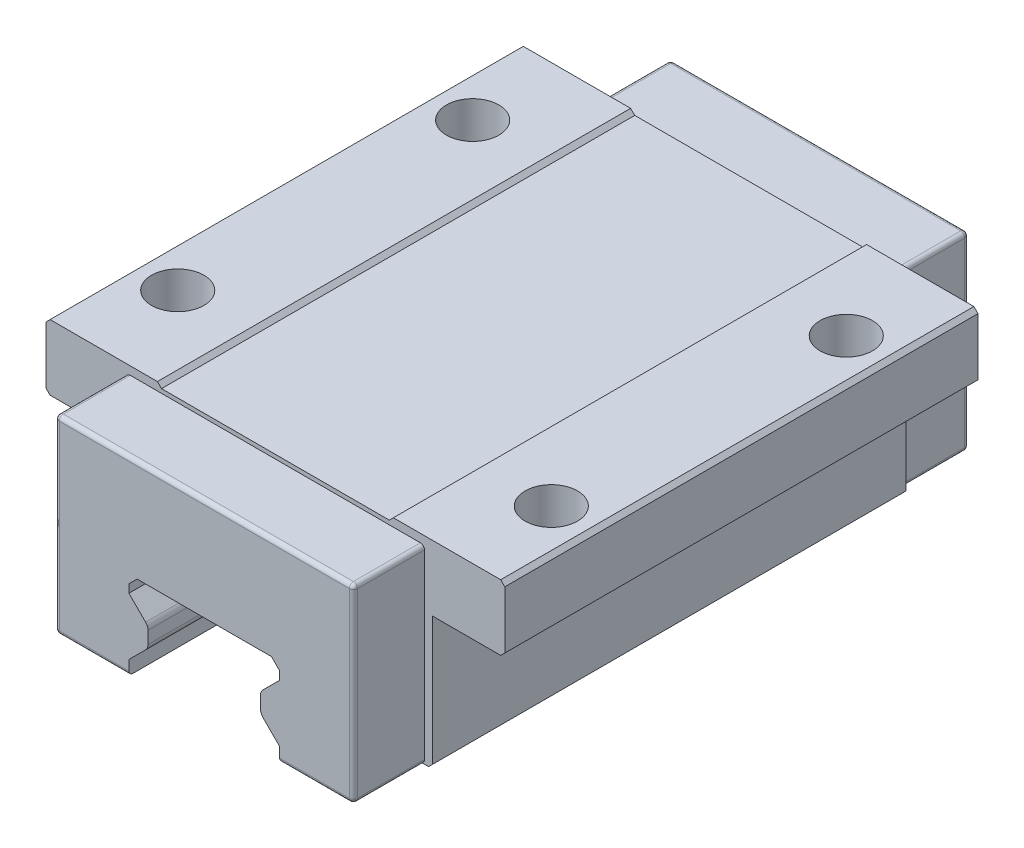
SolidWorks part; units mm, degrees
ref_plane "Front Plane" through (0, 0, 0) normal (0, 0, 1) x (1, 0, 0)
ref_plane "Top Plane" through (0, 0, 0) normal (0, 1, 0) x (1, 0, 0)
ref_plane "Right Plane" through (0, 0, 0) normal (1, 0, 0) x (0, 0, -1)
sketch "Sketch1" plane through (0, 0, 0) normal (0, 0, 1) x (1, 0, 0)
  line L1 (-24, 5.8) -> (24, 5.8)
  line L2 (-24, 5.8) -> (-24, 36)
  line L3 (-24, 36) -> (24, 36)
  line L4 (24, 5.8) -> (24, 36)
  line L5 (-24, 5.8) -> (24, 36) construction
  line L6 (-24, 36) -> (24, 5.8) construction
  point P0 (0, 20.9)
  dimension "D1" = 36
  dimension "D2" = 5.8
  dimension "D3" = 48
extrude "Boss-Extrude1" add sketch "Sketch1" along normal mid plane 72.2
sketch "Sketch2" plane through (0, 0, 0) normal (0, 0, 1) x (1, 0, 0)
  line L0 (-24, 5.8) -> (24, 5.8) construction
  line L1 (-22.75, 5.8) -> (22.75, 5.8)
  line L2 (-22.75, 5.8) -> (-22.75, 34.75)
  line L3 (-22.75, 34.75) -> (22.75, 34.75)
  line L4 (22.75, 5.8) -> (22.75, 34.75)
  line L5 (-22.75, 34.75) -> (-24, 34.75) construction
  line L6 (-24, 36) -> (-24, 5.8) construction
  line L7 (22.75, 34.75) -> (22.75, 36) construction
  line L8 (24, 36) -> (-24, 36) construction
  line L9 (22.75, 34.75) -> (24, 34.75) construction
  line L10 (24, 5.8) -> (24, 36) construction
  point P9 (0, 34.75)
  dimension "D1" = 1.25
extrude "Boss-Extrude2" add sketch "Sketch2" along normal mid plane 93.9
sketch "Sketch3" plane through (0, 0, 46.95) normal (0, 0, 1) x (1, 0, 0)
  line L1 (-11.5, 19.2) -> (11.5, 19.2)
  line L2 (-11.5, 19.2) -> (-11.5, 0)
  line L3 (-11.5, 0) -> (11.5, 0)
  line L4 (11.5, 19.2) -> (11.5, 0)
  line L5 (-11.5, 19.2) -> (11.5, 0) construction
  line L6 (-11.5, 0) -> (11.5, 19.2) construction
  point P0 (0, 9.6)
  dimension "D1" = 23
  dimension "D2" = 19.2
extrude "Cut-Extrude1" cut sketch "Sketch3" against normal through all
sketch "Sketch4" plane through (0, 0, 46.95) normal (0, 0, 1) x (1, 0, 0)
  line L0 (-11.5, 16.7) -> (-11.5, 7.95)
  line L1 (-11.5, 19.2) -> (-11.5, 5.8) construction
  line L2 (-11.5, 7.95) -> (-8.5833, 10.8667)
  line L3 (-8.5833, 10.8667) -> (-8.5833, 13.7833)
  line L4 (-8.5833, 13.7833) -> (-11.5, 16.7)
  line L5 (11.5, 19.2) -> (-11.5, 19.2) construction
  line L6 (-8.5833, 13.7833) -> (-11.5, 13.7833) construction
  line L7 (-8.5833, 10.8667) -> (-11.5, 10.8667) construction
  line L8 (-10.0417, 13.7833) -> (-10.0417, 10.8667) construction
  line L9 (0, 0) -> (0, 19.2) construction
  line L10 (10.0417, 13.7833) -> (10.0417, 10.8667) construction
  line L11 (8.5833, 10.8667) -> (11.5, 10.8667) construction
  line L12 (8.5833, 13.7833) -> (11.5, 13.7833) construction
  line L13 (8.5833, 13.7833) -> (11.5, 16.7)
  line L14 (8.5833, 10.8667) -> (8.5833, 13.7833)
  line L15 (11.5, 7.95) -> (8.5833, 10.8667)
  line L16 (11.5, 16.7) -> (11.5, 7.95)
extrude "Boss-Extrude3" add sketch "Sketch4" against normal up to surface (93.9 mm away)
chamfer "Chamfer1" distance 1.25 angle 45 2 edges at (11.5, 19.2, 0) (-11.5, 19.2, 0)
fillet "Fillet1" radius 1.25 4 edges at (8.5833, 10.8667, 0) (8.5833, 13.7833, 0) (-8.5833, 10.8667, 0) (-8.5833, 13.7833, 0)
sketch "Sketch5" plane through (0, 0, 36.1) normal (0, 0, 1) x (1, 0, 0)
  line L0 (24, 36) -> (-24, 36) construction
  line L1 (-18, 36) -> (18, 36)
  line L2 (-18, 36) -> (-18, 35.375)
  line L3 (-18, 35.375) -> (18, 35.375)
  line L4 (18, 36) -> (18, 35.375)
  point P6 (0, 35.375)
  dimension "D1" = 36
  dimension "D2" = 0.625
extrude "Cut-Extrude2" cut sketch "Sketch5" against normal through all
chamfer "Chamfer2" distance 0.625 angle 45 6 edges at (24, 36, 0) (24, 5.8, 0) (-24, 5.8, 0) (-24, 36, 0) (18, 35.375, 0) (-18, 35.375, 0)
fillet "Fillet2" radius 0.625 18 edges at (-22.75, 5.8, -41.525) (17.125, 5.8, 46.95) (17.125, 5.8, -46.95) (-22.75, 5.8, 41.525) (-17.125, 5.8, -46.95) (-17.125, 5.8, 46.95) (22.75, 5.8, 41.525) (-22.75, 20.275, 46.95) (-22.75, 20.275, -46.95) (-22.75, 34.75, 41.525) (22.75, 34.75, 41.525) (22.75, 20.275, 46.95) (22.75, 20.275, -46.95) (0, 34.75, 46.95) (0, 34.75, -46.95) (22.75, 5.8, -41.525) (22.75, 34.75, -41.525) (-22.75, 34.75, -41.525)
sketch "Sketch7" plane through (0, 0, 0) normal (0, 0, 1) x (1, 0, 0)
  line L0 (-23.375, 36) -> (-35, 36)
  line L1 (-35, 36) -> (-35, 26)
  line L2 (-23.375, 36) -> (-23.375, 15.625)
  line L3 (-24, 35.375) -> (-24, 6.425) construction
  line L4 (-24, 15.625) -> (-23.375, 15.625)
  line L5 (-35, 26) -> (-34.375, 26)
  line L6 (0, 0) -> (0, 35.375) construction
  line L7 (-17.375, 35.375) -> (17.375, 35.375) construction
  line L8 (35, 26) -> (34.375, 26)
  line L9 (24, 15.625) -> (23.375, 15.625)
  line L10 (23.375, 36) -> (23.375, 15.625)
  line L11 (35, 36) -> (35, 26)
  line L12 (23.375, 36) -> (35, 36)
  arc A1 (-34.375, 26) -> (-24, 15.625) centre (-34.375, 15.625) cw
  arc A2 (34.375, 26) -> (24, 15.625) centre (34.375, 15.625) ccw
  point P22 (-34.6875, 26)
  dimension "D1" = 70
  dimension "D2" = 10
  dimension "D3" = 0.625
extrude "Boss-Extrude4" add sketch "Sketch7" along normal mid plane 32.5
sketch "Sketch8" plane through (0, 0, 0) normal (0, 0, 1) x (1, 0, 0)
  line L0 (-35, 26) -> (-35, 36)
  line L9 (35, 26) -> (35, 36)
  line L10 (35, 26) -> (23.375, 26)
  line L11 (35, 36) -> (23.375, 36)
  line L13 (23.375, 36) -> (23.375, 26)
  line L14 (-35, 26) -> (-22.75, 26)
  line L15 (-35, 36) -> (-22.75, 36)
  line L16 (-22.75, 26) -> (-22.75, 36)
  line L17 (-22.75, 34.125) -> (-22.75, 6.425) construction
extrude "Boss-Extrude5" add sketch "Sketch8" along normal mid plane 72.2
chamfer "Chamfer3" distance 0.625 angle 45 4 edges at (-35, 26, 0) (-35, 36, 0) (35, 26, 0) (35, 36, 0)
fillet "Fillet3" radius 6 4 edges at (-24, 20.8125, 16.25) (-24, 20.8125, -16.25) (24, 20.8125, -16.25) (24, 20.8125, 16.25)
sketch "Sketch6" plane through (0, 36, 0) normal (0, 1, 0) x (1, 0, 0)
  line L1 (0, 0) -> (28.5, -22.5) construction
  line L3 (0, 0) -> (-28.5, -22.5) construction
  circle A1 centre (-28.5, -22.5) radius 4
  circle A2 centre (28.5, -22.5) radius 4
  dimension "D1" = 8
  dimension "D2" = 57
  dimension "D3" = 22.5
extrude "Cut-Extrude3" cut sketch "Sketch6" against normal blind 10
mirror "Mirror1" about plane through (0, 0, 0) normal (0, 0, 1) of "Cut-Extrude3"
equation "\"D2@Sketch4\"=\"D1@Sketch4\"*3.5"
